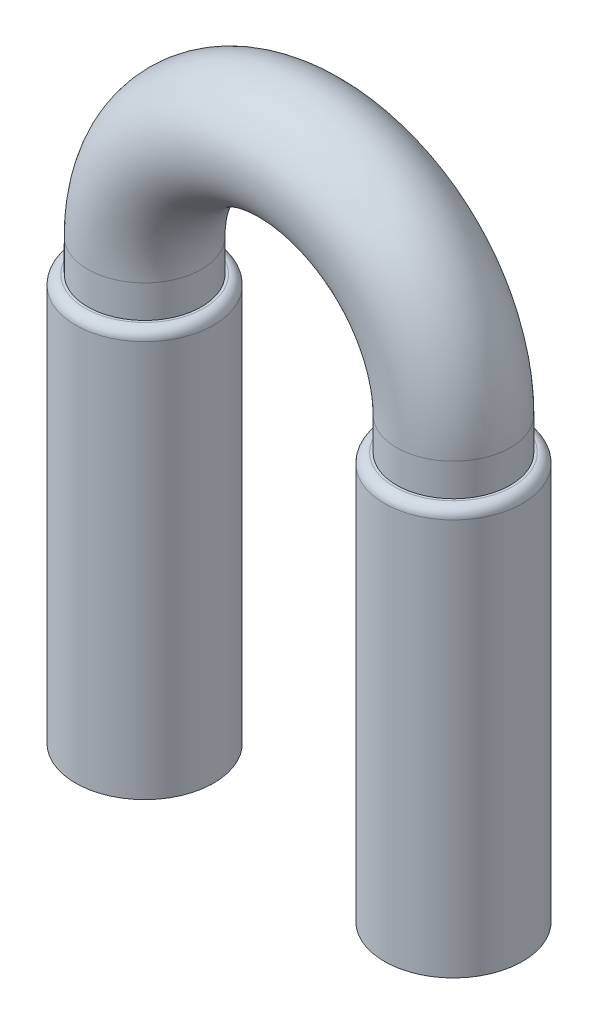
SolidWorks part; units mm, degrees
ref_plane "Plan de face" through (0, 0, 0) normal (0, 0, 1) x (1, 0, 0)
ref_plane "Plan de dessus" through (0, 0, 0) normal (0, 1, 0) x (1, 0, 0)
ref_plane "Plan de droite" through (0, 0, 0) normal (1, 0, 0) x (0, 0, -1)
sketch "Esquisse1" plane through (0, 0, 0) normal (0, 0, 1) x (1, 0, 0)
  line L0 (0, 27) -> (0, 0)
  line L1 (19, 27) -> (19, 0)
  line L2 (0, 0) -> (19, 0) construction
  arc A0 (19, 27) -> (0, 27) centre (9.5, 27) ccw
  point P1 (0, 0)
  dimension "D1" = 19
  dimension "D2" = 27
sketch "Esquisse2" plane through (0, 0, 0) normal (0, 1, 0) x (1, 0, 0)
  circle A0 centre (0, 0) radius 3.5
  dimension "D1" = 7
sweep "Balayage1" add profiles "Esquisse2" path "Esquisse1"
sketch "Esquisse3" plane through (0, 0, 0) normal (0, -1, 0) x (1, 0, 0)
  circle A0 centre (19, 0) radius 4.25
  circle A1 centre (0, 0) radius 4.25
extrude "Boss.-Extru.1" add sketch "Esquisse3" against normal blind 25
fillet "Congé1" radius 0.6 2 edges at (0, 25, -4.25) (19, 25, -4.25)
equation "\"D2@Esquisse3\"=\"D1@Esquisse3\""
